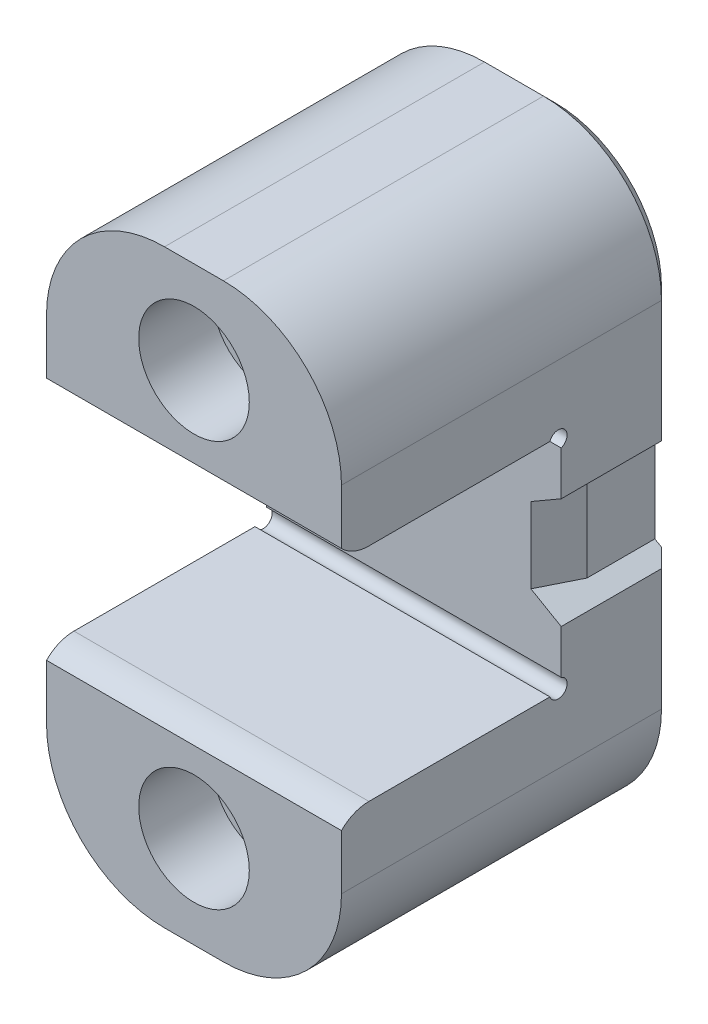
SolidWorks part; units mm, degrees
ref_plane "Front Plane" through (0, 0, 0) normal (0, 0, 1) x (1, 0, 0)
ref_plane "Top Plane" through (0, 0, 0) normal (0, 1, 0) x (1, 0, 0)
ref_plane "Right Plane" through (0, 0, 0) normal (1, 0, 0) x (0, 0, -1)
sketch "Sketch1" plane through (0, 0, 0) normal (1, 0, 0) x (0, 0, -1)
  line L0 (0, 0) -> (50000, 0) construction
  line L1 (0, 9.525) -> (18.923, 9.525)
  line L2 (0, 25.4) -> (28.575, 25.4)
  line L3 (0, 25.4) -> (0, 9.525)
  line L4 (0, -25.4) -> (28.575, -25.4)
  line L5 (28.575, 25.4) -> (28.575, -25.4)
  line L6 (18.923, 9.525) -> (18.923, -9.525)
  line L7 (18.923, -9.525) -> (0, -9.525)
  line L9 (0, 13.97) -> (0, -13.97) construction
  line L10 (0, -9.525) -> (0, -25.4)
  dimension "D1" = 28.575
  dimension "D2" = 50.8
  dimension "D3" = 18.923
  dimension "D4" = 19.05
extrude "Extrude1" add sketch "Sketch1" along normal mid plane 25.4
fillet "Fillet1" radius 10.16 4 edges at (-12.7, -25.4, -14.2875) (-12.7, 25.4, -14.2875) (12.7, -25.4, -14.2875) (12.7, 25.4, -14.2875)
sketch "Sketch2" plane through (-15.875, 0, -28.575) normal (0, 0, 1) x (1, 0, 0)
  line L0 (0, 0) -> (50000, 0) construction
  line L1 (28.575, -15.24) -> (28.575, 15.24) construction
  line L2 (26.9875, 3.846) -> (30.1625, 5.679)
  line L3 (26.9875, 3.846) -> (26.9875, -3.846)
  line L4 (26.9875, -3.846) -> (30.1625, -5.679)
  line L5 (30.1625, 5.679) -> (30.1625, -5.679)
  point P4 (28.575, 4.7625)
  point P10 (28.575, -4.7625)
  dimension "D1" = 9.525
  dimension "D2" = 1.5875
  dimension "D3" = 30
  dimension "D4" = 3.175
extrude "Cut-Extrude1" cut sketch "Sketch2" along normal through all
sketch "Sketch5" plane through (12.7, 0, 0) normal (1, 0, 0) x (0, 0, -1)
  line L0 (0, 0) -> (50000, 0) construction
  line L1 (0, 9.525) -> (18.923, 9.525) construction
  line L2 (0, 15.24) -> (0, 9.525) construction
  line L3 (0, -9.525) -> (0, -15.24) construction
  line L4 (-3.9878, -7.346) -> (2.3622, -7.346)
  line L5 (-3.9878, -7.346) -> (-3.9878, -10.521)
  line L6 (-3.9878, -10.521) -> (0, -10.521)
  line L7 (2.3622, -7.346) -> (2.3622, -9.525)
  line L8 (18.923, -9.525) -> (0, -9.525) construction
  line L9 (2.3622, 7.346) -> (2.3622, 9.525)
  line L10 (-3.9878, 10.521) -> (0, 10.521)
  line L11 (-3.9878, 7.346) -> (-3.9878, 10.521)
  line L12 (-3.9878, 7.346) -> (2.3622, 7.346)
  arc A0 (0.5438, -9.7909) -> (2.3622, -9.525) centre (2.3622, -15.875) cw construction
  arc A1 (0, -10.521) -> (0.5438, -9.7909) centre (0.762, -10.521) cw construction
  arc A2 (0, 10.521) -> (0.5438, 9.7909) centre (0.762, 10.521) ccw construction
  arc A3 (0.5438, 9.7909) -> (2.3622, 9.525) centre (2.3622, 15.875) ccw construction
  arc A4 (0, 10.521) -> (2.3622, 9.525) centre (2.3622, 12.8242) ccw
  arc A5 (0, -10.521) -> (2.3622, -9.525) centre (2.3622, -12.8242) cw
  dimension "D1" = 0.762
  dimension "D2" = 6.35
  dimension "D3" = 3.175
  dimension "D4" = 6.35
  dimension "D5" = 2.3622
extrude "Cut-Extrude2" cut sketch "Sketch5" against normal through all
sketch "Sketch6" plane through (12.7, 0, 0) normal (1, 0, 0) x (0, 0, -1)
  line L0 (0, 0) -> (50000, 0) construction
  line L3 (18.923, 9.525) -> (18.923, 4.7625) construction
  line L4 (2.3622, 9.525) -> (18.923, 9.525) construction
  circle A0 centre (18.669, 9.271) radius 0.762
  circle A1 centre (18.669, -9.271) radius 0.762
  dimension "D2" = 0.508
  dimension "D3" = 0.762
  dimension "D1" = 0.508
extrude "Cut-Extrude3" cut sketch "Sketch6" against normal through all
hole_wizard "#10 CBORE" positions "Sketch4" profile "Sketch3" counterbore size "#10" standard "Ansi Inch"
sketch "Sketch4" plane through (0, 0, 0) normal (0, 0, 1) x (1, 0, 0)
  line L0 (0, 0) -> (0, 50000) construction
  line L1 (0, 0) -> (50000, 0) construction
  point P0 (0, 17.4625)
  point P12 (0, -17.4625)
  dimension "D1" = 34.925
sketch "Sketch3" plane through (0, 17.4625, 0) normal (1, 0, 0) x (0, -1, 0)
  line L0 (0, 0) -> (0, 28.575)
  line L1 (0, 28.575) -> (2.286, 28.575)
  line L3 (2.286, 28.575) -> (2.286, 6.35)
  line L4 (2.286, 6.35) -> (4.7625, 6.35)
  line L5 (4.7625, 6.35) -> (4.7625, 0)
  line L7 (4.7625, 0) -> (0, 0)
  line L11 (0, -6.35) -> (0, 107.95) construction
  dimension "Thru Hole Dia." = 4.572
  dimension "Thru Hole Depth" = 28.575
  dimension "C'Bore Dia." = 9.525
  dimension "C'Bore Depth" = 6.35
hole_wizard "1/4-20 Tapped Hole1" positions "Sketch8" profile "Sketch7" tap size "1/4-20" standard "Ansi Inch"
sketch "Sketch8" plane through (0, 0, -6.35) normal (0, 0, 1) x (1, 0, 0)
  point P0 (0, -17.4625)
  point P1 (0, 17.4625)
sketch "Sketch7" plane through (0, -17.4625, -6.35) normal (1, 0, 0) x (0, -1, 0)
  line L0 (0, 0) -> (0, 22.225)
  line L1 (0, 22.225) -> (2.5527, 22.225)
  line L2 (2.5527, 22.225) -> (2.5527, 0)
  line L5 (2.5527, 0) -> (0, 0)
  line L11 (0, -6.35) -> (0, 107.95) construction
  dimension "Thread Major Dia." = 5.1054
  dimension "Thru Tap Drill Depth" = 22.225
chamfer "Chamfer3" distance 3.81 angle 15 1 edges at (11.1125, 0, -18.923)
chamfer "Chamfer1" distance 1.016 angle 45 9 edges at (-12.7, 0, -28.575) (-9.7242, -22.4242, -28.575) (0, -25.4, -28.575) (0, 25.4, -28.575) (-9.7242, 22.4242, -28.575) (12.7, -10.0012, -28.575) (9.7242, -22.4242, -28.575) (12.7, 10.0012, -28.575) (9.7242, 22.4242, -28.575)
